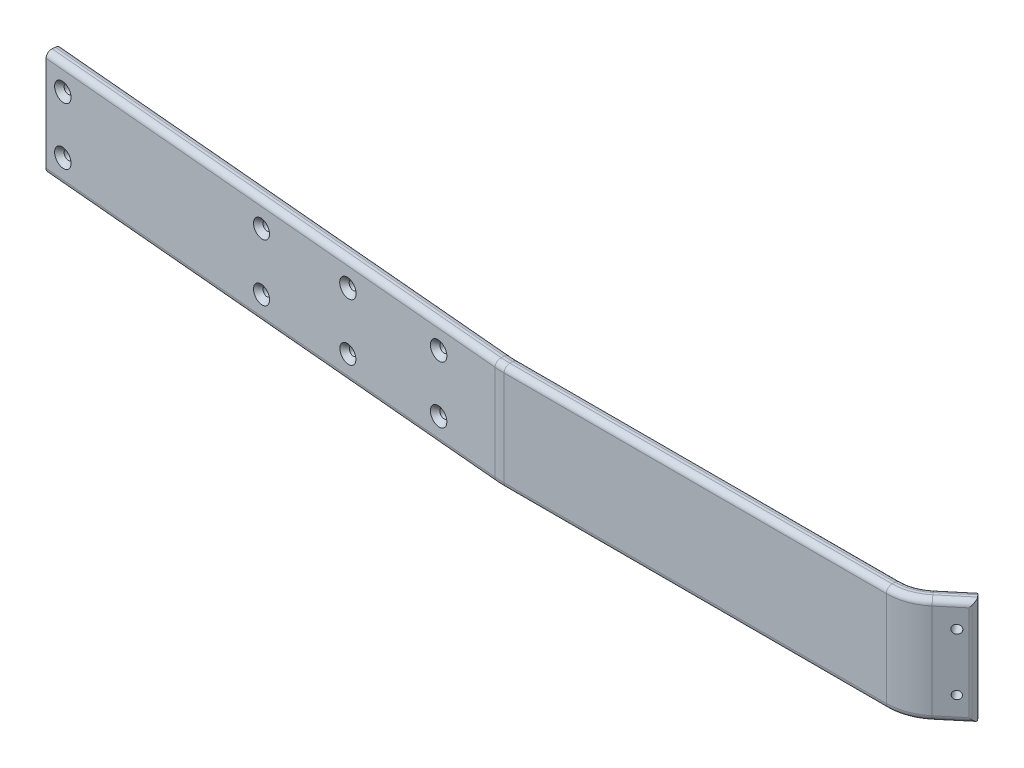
SolidWorks part; units mm, degrees
ref_plane "Plan1" through (0, 0, 0) normal (0, 0, 1) x (1, 0, 0)
ref_plane "Plan2" through (0, 0, 0) normal (0, 1, 0) x (1, 0, 0)
ref_plane "Plan3" through (0, 0, 0) normal (1, 0, 0) x (0, 0, -1)
sketch "Esquisse1" plane through (0, 0, 0) normal (0, 0, 1) x (1, 0, 0)
  line L0 (-1401, 112) -> (-403, 112)
  line L1 (-1401, 112) -> (-1401, 0)
  line L2 (-403, 0) -> (-1401, 0)
  line L3 (-403, 112) -> (-403, 0)
  line L5 (-1101.5, 155) -> (-1101.5, -114) construction
  circle A0 centre (-1051.5, 86) radius 4.5
  circle A1 centre (-946.5, 86) radius 4.5
  circle A2 centre (-946.5, 26) radius 4.5
  circle A3 centre (-418, 86) radius 4.5
  circle A4 centre (-1381.5, 86) radius 4.5
  circle A5 centre (-1381.5, 26) radius 4.5
  circle A14 centre (-1151.5, 26) radius 4.25
  circle A15 centre (-1051.5, 26) radius 4.25
  circle A16 centre (-1151.5, 86) radius 4.25
  circle A19 centre (-418, 26) radius 4.25
  point P10 (-1401, 0)
  dimension "D3" = 998
  dimension "D4" = 60
  dimension "D7" = 9
  dimension "D5" = 26
  dimension "D6" = 19.5
  dimension "D8" = 15
  dimension "D9" = 528.5
  dimension "D10" = 112
  dimension "D12" = 105
  dimension "D14" = 230
  dimension "D16" = 100
  dimension "D23" = 50
extrude "Base-Extrusion" add sketch "Esquisse1" along normal blind 15
sheet metal parameters "Tôlerie 1" parameters "D1"=40
flatten bends "Dépliage 1" parameters "D1"=0
sketch "Esquisse-Angle1" plane through (0, 0, 0) normal (0, 0, -1) x (-1, 0, 0)
process bends "Pliage 1" parameters "D1"=0
sketch "Esquisse-Plate1" plane through (0, 0, 0) normal (0, 0, -1) x (-1, 0, 0)
  line L0 (453, 112) -> (453, 0)
  line L1 (1401, 112) -> (403, 112) construction
  line L2 (403, 0) -> (1401, 0) construction
  line L3 (403, 112) -> (403, 0) construction
  line L4 (876.5, 112) -> (876.5, 0)
  point P9 (475.4, 56)
  dimension "D1" = 50
  dimension "D2" = 70
bend "Pli défini à plat1" bend radius 40 bend angle 40 parameters "D5"=1
bend "Pli défini à plat2" bend radius 100 bend angle 5 parameters "D5"=2
fillet "Congé1" radius 6
chamfer "Chanfrein1" distance 5 angle 45
